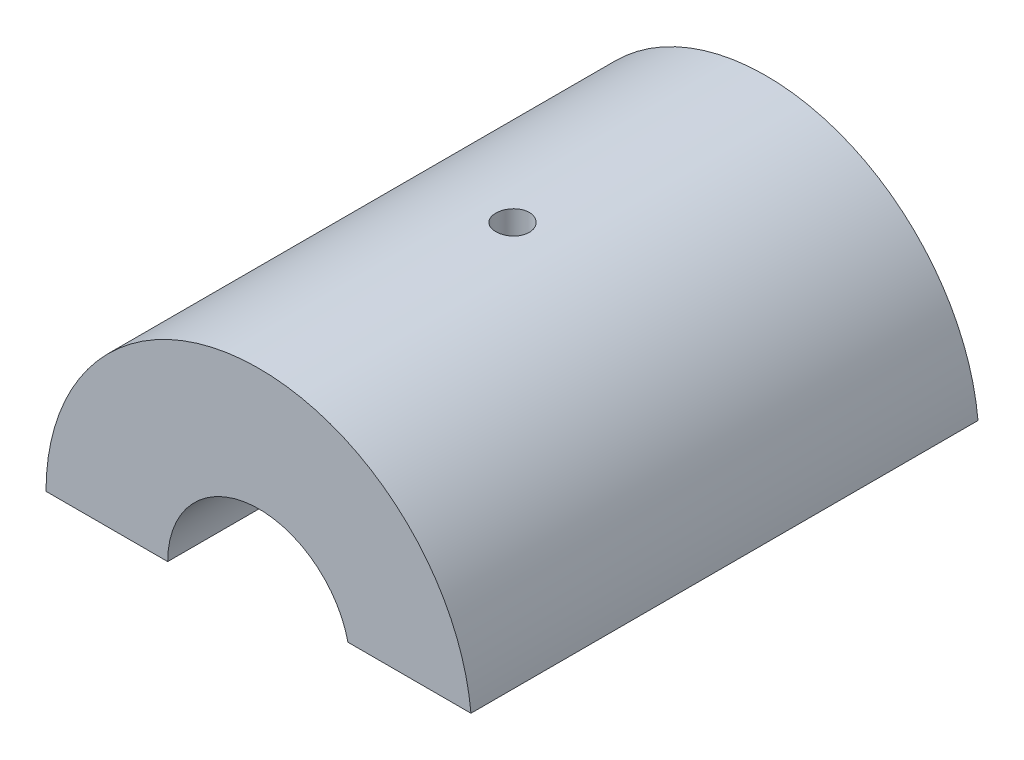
SolidWorks part; units mm, degrees
ref_plane "Face" through (0, 0, 0) normal (0, 0, 1) x (1, 0, 0)
ref_plane "Dessus" through (0, 0, 0) normal (0, 1, 0) x (1, 0, 0)
ref_plane "Droite" through (0, 0, 0) normal (1, 0, 0) x (0, 0, -1)
sketch "Esquisse1" plane through (0, 0, 0) normal (0, 0, 1) x (1, 0, 0)
  line L0 (-9, 0) -> (-21, 0)
  line L1 (8.775, 2) -> (20.9045, 2)
  arc A0 (20.9045, 2) -> (-21, 0) centre (0, 0) ccw
  arc A1 (8.775, 2) -> (-9, 0) centre (0, 0) ccw
  dimension "D1" = 42
  dimension "D2" = 18
  dimension "D3" = 2
extrude "Extrusion1" add sketch "Esquisse1" along normal blind 50
sketch "Esquisse2" plane through (0, 0, 0) normal (0, -1, 0) x (1, 0, 0)
  line L0 (-9, 0) -> (8.775, 0) construction
  line L1 (-21, 50) -> (-21, 0) construction
  circle A0 centre (0, 25) radius 4
  dimension "D1" = 8
  dimension "D2" = 25
  dimension "D3" = 21
extrude "Enlèv. mat.-Extru.1" cut sketch "Esquisse2" against normal blind 17
hole_wizard "Trou taraudé M41" positions "Esquisse4" profile "Esquisse3" tap size "M4" standard "ISO"
sketch "Esquisse4" plane through (0, 17, 0) normal (0, -1, 0) x (1, 0, 0)
  circle A0 centre (0, 25) radius 4 construction
  point P0 (0, 25)
sketch "Esquisse3" plane through (0, 17, 25) normal (1, 0, 0) x (0, 0, -1)
  line L0 (0, 0) -> (0, 4)
  line L1 (0, 4) -> (1.65, 4)
  line L2 (1.65, 4) -> (1.65, 0)
  line L5 (1.65, 0) -> (0, 0)
  line L11 (0, -6.35) -> (0, 107.95) construction
  dimension "Diamètre du trou pour taraudage jusqu'au prochain" = 3.3
  dimension "Profondeur du trou pour taraudage jusqu'au prochain" = 4
